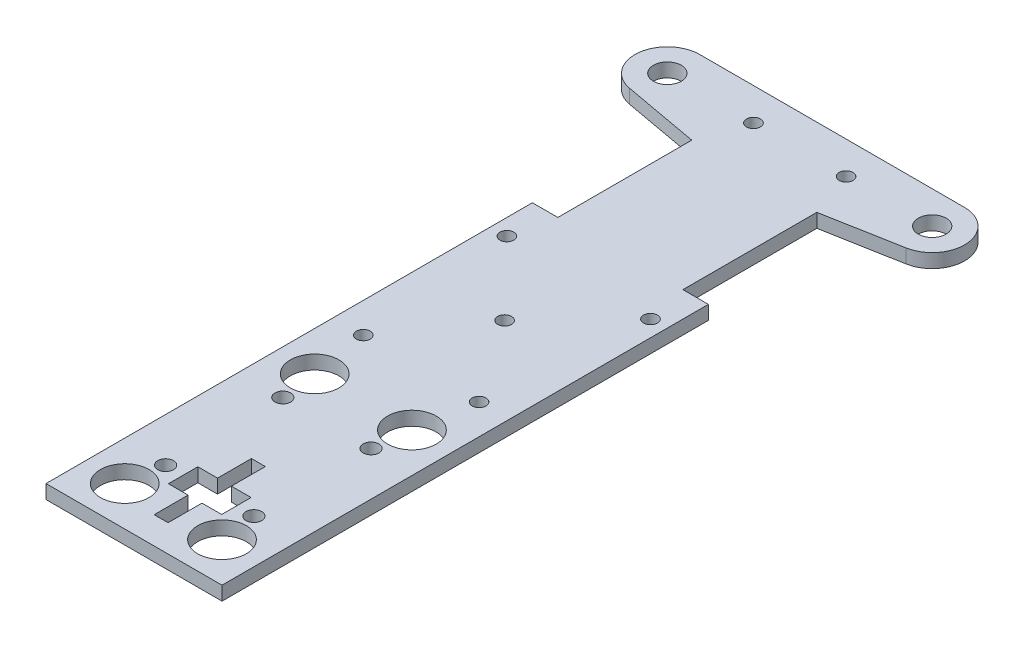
SolidWorks part; units mm, degrees
ref_plane "Alzado" through (0, 0, 0) normal (0, 0, 1) x (1, 0, 0)
ref_plane "Planta" through (0, 0, 0) normal (0, 1, 0) x (1, 0, 0)
ref_plane "Vista lateral" through (0, 0, 0) normal (1, 0, 0) x (0, 0, -1)
sketch "Croquis1" plane through (0, 0, 0) normal (0, 1, 0) x (1, 0, 0)
  line L0 (16, 52) -> (16, 0) construction
  line L1 (32, 0) -> (0, 0)
  line L2 (32, 0) -> (32, 52)
  line L3 (32, 52) -> (0, 52)
  line L4 (0, 0) -> (0, 52)
  line L5 (0, 26) -> (32, 26) construction
  circle A0 centre (26.5, 46.5) radius 4
  circle A1 centre (26.5, 5.5) radius 4
  circle A2 centre (5.5, 5.5) radius 4
  circle A3 centre (5.5, 46.5) radius 4
  point P0 (0, 0)
  dimension "D3" = 41
  dimension "D4" = 8
  dimension "D5" = 21
  dimension "D6" = 41
  dimension "D1" = 32
  dimension "D2" = 52
extrude "Saliente-Extruir1" add sketch "Croquis1" along normal blind 3
sketch "Croquis2" plane through (0, 0, -52) normal (0, 0, -1) x (-1, 0, 0)
  line L4 (-32, 0) -> (0, 0)
  line L5 (0, 0) -> (0, 3)
  line L6 (0, 3) -> (-32, 3)
  line L7 (-32, 3) -> (-32, 0)
  line L8 (-32, 0) -> (0, 0)
  line L9 (0, 0) -> (0, 3)
  line L10 (0, 3) -> (-32, 3)
  line L11 (-32, 3) -> (-32, 0)
  dimension "D1" = 0
extrude "Saliente-Extruir2" add sketch "Croquis2" along normal blind 50
sketch "Croquis3" plane through (0, 3, 0) normal (0, 1, 0) x (1, 0, 0)
  line L1 (10.25, 16.5274) -> (21.75, 16.5274)
  line L2 (10.25, 16.5274) -> (10.25, 10.1774)
  line L3 (10.25, 10.1774) -> (21.75, 10.1774)
  line L4 (21.75, 16.5274) -> (21.75, 10.1774)
extrude "Cortar-Extruir1" cut sketch "Croquis3" against normal through all both and the other way through all
sketch "Croquis4" plane through (0, 0, 0) normal (0, -1, 0) x (1, 0, 0)
  circle A0 centre (25.525, -13.3524) radius 1.7
  circle A1 centre (6.475, -13.3524) radius 1.7
extrude "Cortar-Extruir2" cut sketch "Croquis4" against normal through all both and the other way through all
sketch "Croquis5" plane through (0, 3, 0) normal (0, 1, 0) x (1, 0, 0)
  line L0 (16, 16.5274) -> (16, 10.1774) construction
  line L1 (21.75, 16.5274) -> (10.25, 16.5274) construction
  line L2 (10.25, 10.1774) -> (21.75, 10.1774) construction
  line L4 (17.5, 2.8524) -> (14.5, 2.8524)
  line L5 (17.5, 2.8524) -> (17.5, 23.8524)
  line L6 (17.5, 23.8524) -> (14.5, 23.8524)
  line L7 (14.5, 2.8524) -> (14.5, 23.8524)
  line L8 (17.5, 2.8524) -> (14.5, 23.8524) construction
  line L9 (17.5, 23.8524) -> (14.5, 2.8524) construction
  point P6 (16, 13.3524)
  dimension "D1" = 3
  dimension "D2" = 21
extrude "Cortar-Extruir3" cut sketch "Croquis5" against normal through all both and the other way through all
sketch "Croquis6" plane through (0, 3, 0) normal (0, 1, 0) x (1, 0, 0)
  line L0 (5.5, 46.5) -> (5.5, 5.5) construction
  line L1 (5.5, 26) -> (32, 26) construction
  line L2 (32, 0) -> (32, 102) construction
  circle A0 centre (25.525, 13.3524) radius 1.7 construction
  circle A1 centre (6.475, 13.3524) radius 1.7 construction
  circle A2 centre (25.525, 13.3524) radius 1.7
  circle A3 centre (6.475, 13.3524) radius 1.7
  circle A4 centre (25.525, 38.6476) radius 1.7
  circle A5 centre (6.475, 38.6476) radius 1.7
extrude "Cortar-Extruir4" cut sketch "Croquis6" against normal through all both and the other way through all
sketch "Croquis7" plane through (0, 3, 0) normal (0, 1, 0) x (1, 0, 0)
  circle A0 centre (3.5, 59) radius 1.5
  circle A1 centre (28.5, 59) radius 1.5
extrude "Cortar-Extruir5" cut sketch "Croquis7" against normal through all both and the other way through all
sketch "Croquis8" plane through (0, 0, 0) normal (-1, 0, 0) x (0, 0, 1)
  line L0 (-102, 3) -> (0, 3) construction
  line L1 (-102, 0) -> (-53, 0)
  line L2 (-102, 0) -> (-102, 3)
  line L3 (-102, 3) -> (-53, 3)
  line L4 (-53, 0) -> (-53, 3)
  line L5 (0, 3) -> (0, 0) construction
  dimension "D1" = 53
extrude "Saliente-Extruir3" add sketch "Croquis8" along normal blind 3
ref_plane "Plano1" through (16, 0, 0) normal (-1, 0, 0) x (0, 0, 1)
mirror "Simetría1" about plane through (16, 0, 0) normal (-1, 0, 0) of "Saliente-Extruir3"
sketch "Croquis9" plane through (0, 3, 0) normal (0, 1, 0) x (1, 0, 0)
  line L0 (16, 0) -> (16, 207.6609) construction
  line L1 (0, 0) -> (32, 0) construction
  line L2 (-3, 102) -> (35, 102) construction
  line L3 (2.5, 102) -> (29.5, 102)
  line L4 (2.5, 102) -> (2.5, 127)
  line L5 (2.5, 127) -> (29.5, 127)
  line L6 (29.5, 102) -> (29.5, 127)
  point P10 (16, 127)
  dimension "D1" = 27
  dimension "D2" = 25
extrude "Saliente-Extruir4" add sketch "Croquis9" against normal up to surface (3 mm away)
sketch "Croquis10" plane through (0, 0, 0) normal (0, -1, 0) x (1, 0, 0)
  line L0 (29.5, -127) -> (29.5, -132.9441)
  line L2 (29.5, -132.9441) -> (45.4379, -135.8619)
  line L4 (2.5, -127) -> (2.5, -132.9258)
  line L6 (2.5, -132.9258) -> (-13.5381, -135.8615)
  line L7 (-12.6377, -145.7801) -> (44.0404, -145.7553)
  line L8 (2.5, -127) -> (29.5, -127)
  arc A0 (44.0404, -145.7553) -> (45.4379, -135.8619) centre (44.5375, -140.7801) ccw
  arc A1 (-13.5381, -135.8615) -> (-12.6377, -145.7801) centre (-12.6399, -140.7801) ccw
  circle A2 centre (-12.6399, -140.7801) radius 3
  circle A3 centre (44.5375, -140.7801) radius 3
extrude "Saliente-Extruir5" add sketch "Croquis10" against normal up to surface (3 mm away)
sketch "Croquis12" plane through (0, 3, 0) normal (0, 1, 0) x (1, 0, 0)
  circle A0 centre (31.5, 93) radius 1.5
  circle A1 centre (16, 77) radius 1.5
  circle A2 centre (0.5, 93) radius 1.5
extrude "Cortar-Extruir6" cut sketch "Croquis12" against normal through all both and the other way through all
sketch "Croquis14" plane through (0, 3, 0) normal (0, 1, 0) x (1, 0, 0)
  line L0 (-12.6399, 147.7801) -> (44.5375, 147.7801)
  line L1 (-13.8928, 133.8932) -> (2.5, 130.9109)
  line L2 (2.5, 132.9258) -> (2.5, 102) construction
  line L3 (2.5, 130.9109) -> (29.5, 130.9109)
  line L4 (29.5, 102) -> (29.5, 132.9441) construction
  line L5 (29.5, 130.9109) -> (45.7981, 133.8946)
  line L7 (45.4379, 135.8619) -> (29.5, 132.9441) construction
  arc A0 (-12.6399, 147.7801) -> (-13.8928, 133.8932) centre (-12.6399, 140.7801) ccw
  arc A1 (45.7981, 133.8946) -> (44.5375, 147.7801) centre (44.5375, 140.7801) ccw
  circle A2 centre (-12.6399, 140.7801) radius 3
  circle A3 centre (44.5375, 140.7801) radius 3
  dimension "D1" = 14
extrude "Saliente-Extruir6" add sketch "Croquis14" against normal up to surface (3 mm away)
sketch "Croquis15" plane through (0, 3, 0) normal (0, 1, 0) x (1, 0, 0)
  circle A0 centre (5.9499, 140.7801) radius 1.5
  circle A1 centre (25.9499, 140.7801) radius 1.5
extrude "Cortar-Extruir7" cut sketch "Croquis15" against normal through all both and the other way through all
sketch "Croquis16" plane through (0, 0, -53) normal (0, 0, 1) x (1, 0, 0)
  line L0 (32, 3) -> (32, 0) construction
  line L1 (32, 0) -> (35, 0) construction
  line L2 (35, 0) -> (35, 3) construction
  line L3 (35, 3) -> (32, 3) construction
  line L4 (0, 0) -> (0, 3) construction
  line L5 (0, 3) -> (-3, 3) construction
  line L6 (-3, 3) -> (-3, 0) construction
  line L7 (-3, 0) -> (0, 0) construction
  line L8 (32, 3) -> (32, 0)
  line L9 (32, 0) -> (35, 0)
  line L10 (35, 0) -> (35, 3)
  line L11 (35, 3) -> (32, 3)
  line L12 (0, 0) -> (0, 3)
  line L13 (0, 3) -> (-3, 3)
  line L14 (-3, 3) -> (-3, 0)
  line L15 (-3, 0) -> (0, 0)
extrude "Saliente-Extruir7" add sketch "Croquis16" along normal offset from surface (56 mm away) 3
sketch "Croquis17" plane through (0, 0, 0) normal (0, 0, 1) x (1, 0, 0)
  line L4 (0, 0) -> (32, 0)
  line L5 (32, 0) -> (32, 3)
  line L6 (32, 3) -> (0, 3)
  line L7 (0, 3) -> (0, 0)
  line L8 (0, 0) -> (32, 0)
  line L9 (32, 0) -> (32, 3)
  line L10 (32, 3) -> (0, 3)
  line L11 (0, 3) -> (0, 0)
  dimension "D1" = 0
extrude "Saliente-Extruir8" add sketch "Croquis17" along normal up to surface (3 mm away)
sketch "Croquis18" plane through (0, 3, 0) normal (0, 1, 0) x (1, 0, 0)
  circle A0 centre (5.5, 46.5) radius 5.25
  circle A1 centre (26.5, 46.5) radius 5.25
  circle A2 centre (26.5, 5.5) radius 5.25
  circle A3 centre (5.5, 5.5) radius 5.25
  dimension "D1" = 10.5
extrude "Cortar-Extruir8" cut sketch "Croquis18" against normal through all both and the other way through all
